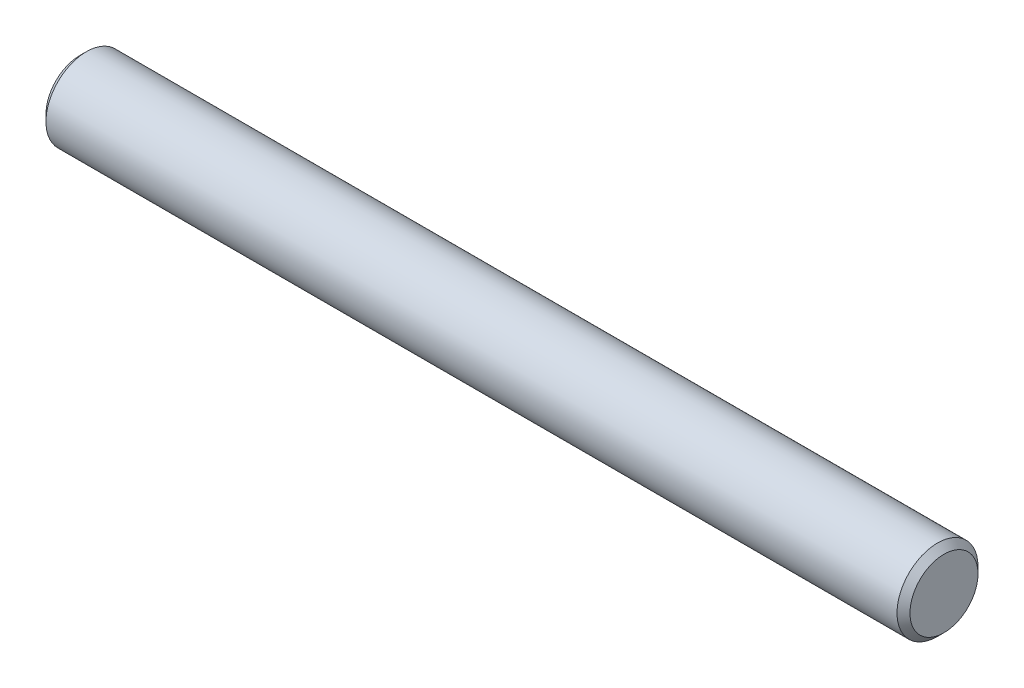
SolidWorks part; units mm, degrees
ref_plane "Front" through (0, 0, 0) normal (0, 0, 1) x (1, 0, 0)
ref_plane "Top" through (0, 0, 0) normal (0, 1, 0) x (1, 0, 0)
ref_plane "Right" through (0, 0, 0) normal (1, 0, 0) x (0, 0, -1)
sketch "Sketch1" plane through (0, 0, 0) normal (1, 0, 0) x (0, 0, -1)
  circle A0 centre (0, 0) radius 2.3812
  dimension "D1" = 4.7625
extrude "Extrude1" add sketch "Sketch1" along normal blind 50.8
chamfer "Chamfer1" distance 0.381 angle 45 2 edges at (0, 0, -2.3812) (50.8, 0, -2.3812)
